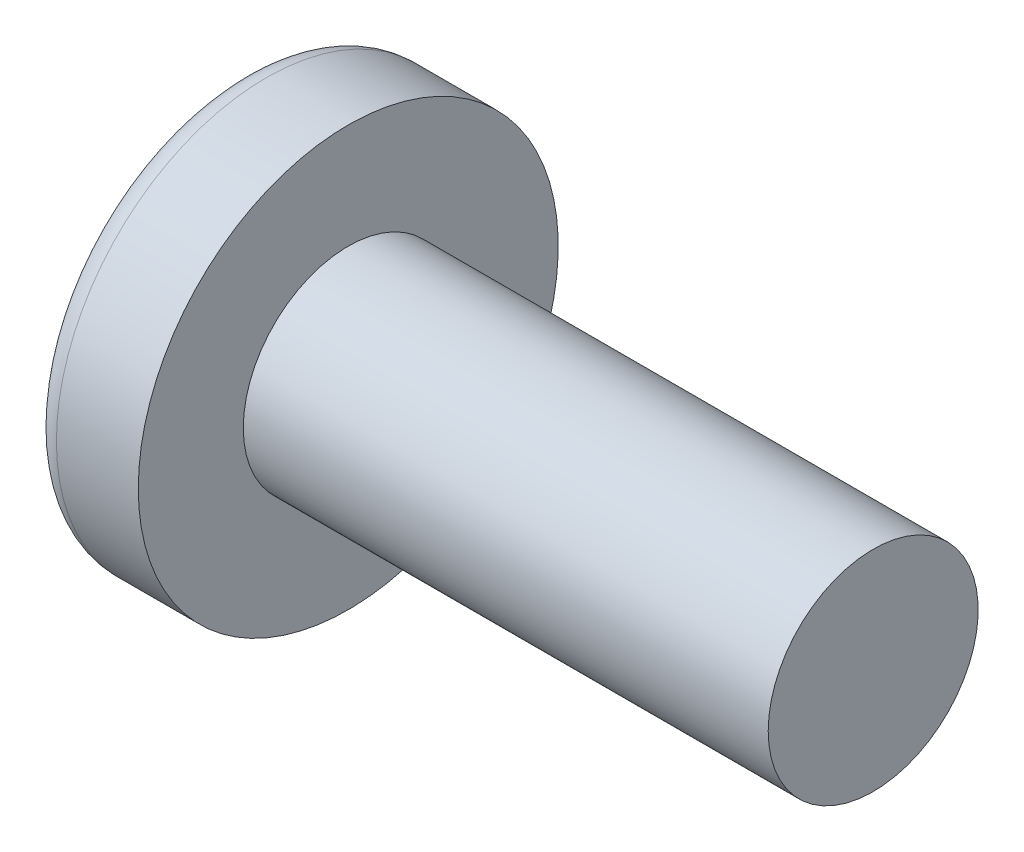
SolidWorks part; units mm, degrees
ref_plane "Plane1" through (0, 0, 0) normal (0, 0, 1) x (1, 0, 0)
ref_plane "Plane2" through (0, 0, 0) normal (0, 1, 0) x (1, 0, 0)
ref_plane "Plane3" through (0, 0, 0) normal (1, 0, 0) x (0, 0, -1)
sketch "BodySke" plane through (0, 0, 0) normal (0, 0, 1) x (1, 0, 0)
  line L0 (1.6, 1) -> (1.6, 2)
  line L1 (2, 6.35) -> (2, -3.175) construction
  line L2 (-25.4, 0) -> (127, 0) construction
  line L3 (6.6, 0) -> (0, 0)
  line L4 (1.6, 1) -> (6.6, 1)
  line L5 (6.6, 1) -> (6.6, 0)
  line L6 (0.8201, 2) -> (1.6, 2)
  line L7 (1.6, -1) -> (6.6, -1) construction
  line L8 (1.6, 6.35) -> (1.6, -3.175) construction
  arc A0 (0.6271, 1.9027) -> (0, 0) centre (3.2, 0) ccw
  arc A2 (0.6271, 1.9027) -> (0.8201, 2) centre (0.8201, 1.76) cw
revolve "Base-Revolve" add sketch "BodySke" angle 360 about L2
sketch "Sketch3" plane through (0, 0, 0) normal (1, 0, 0) x (0, 0, -1)
  line L0 (0.24, -0.91) -> (-0.24, -0.91)
  line L1 (0.24, -0.91) -> (0.24, 0.91)
  line L2 (-0.24, 0.91) -> (0.24, 0.91)
  line L3 (-0.24, 0.91) -> (-0.24, -0.91)
ref_plane "Plane4" through (1.19, 0, 0) normal (1, 0, 0) x (0, 0, -1)
sketch "Sketch4" plane through (1.19, 0, 0) normal (1, 0, 0) x (0, 0, -1)
  line L0 (0.12, -0.12) -> (-0.12, -0.12)
  line L1 (0.12, -0.12) -> (0.12, 0.12)
  line L2 (-0.12, 0.12) -> (0.12, 0.12)
  line L3 (-0.12, 0.12) -> (-0.12, -0.12)
loft "Cut-Loft1" cut profiles "Sketch3", "Sketch4"
pattern_circular "CirPattern1" count 2 every 90 about axis through (0, 0, 0) along (1, 0, 0) of "Cut-Loft1"
sketch "ThdSchSke" plane through (0, 0, 0) normal (0, 0, 1) x (1, 0, 0)
  line L0 (2, -0.774) -> (1.8418, -1)
  line L1 (2, -0.774) -> (2.1582, -1)
  line L2 (2.1582, -1) -> (2.1582, -1.25)
  line L3 (-3.175, 0) -> (5.1513, 0) construction
  line L5 (2.1582, -1.25) -> (1.8418, -1.25)
  line L6 (1.8418, -1.25) -> (1.8418, -1)
revolve "ThreadSchematic" [suppressed] cut sketch "ThdSchSke" angle 360 about L3
pattern_linear "ThdSchPat" [suppressed]
equation "\"D1@Sketch3\" = \"Cross_dia@Sketch3\" / 2"
equation "\"D2@Sketch3\" = \"Cross_width@Sketch3\" / 2"
equation "\"D1@Sketch4\" = \"Cross_width@Sketch3\" *.5"
equation "\"D2@Sketch4\" = \"D1@Sketch4\""
equation "\"D3@Sketch4\" = \"D1@Sketch4\" / 2"
equation "\"D4@Sketch4\" = \"D2@Sketch4\" / 2"
equation "\"Thread_length@ThreadCosmetic\" = ((sgn( (\"Length@BodySke\" - \"Advance@BodySke\" ) - \"Thread_nom@BodySke\" )-1)*( (\"Length@BodySke\" - \"Advance@BodySke\" ) - \"Thread_nom@BodySke\" ))/-2+ \"Thread_nom@BodySke\""
equation "\"Thread_minor@ThdSchSke\" = \"Thread_minor@ThreadCosmetic\""
equation "\"Diameter@ThdSchSke\" = \"Diameter@BodySke\""
equation "\"Overcut@ThdSchSke\" = \"Diameter@BodySke\" * 1.25"
equation "\"Start@ThdSchSke\" = \"Head_ht@BodySke\" + \"Length@BodySke\" - \"Thread_length@ThreadCosmetic\"  '---Non-countersunk---"
equation "\"Num_threads@ThdSchPat\" = int( \"Thread_length@ThreadCosmetic\" / \"Advance@BodySke\" + 0.999 )  + 1"
equation "\"Advance@ThdSchPat\" = \"Thread_length@ThreadCosmetic\" /  (\"Num_threads@ThdSchPat\" - 1) 'relax it"
